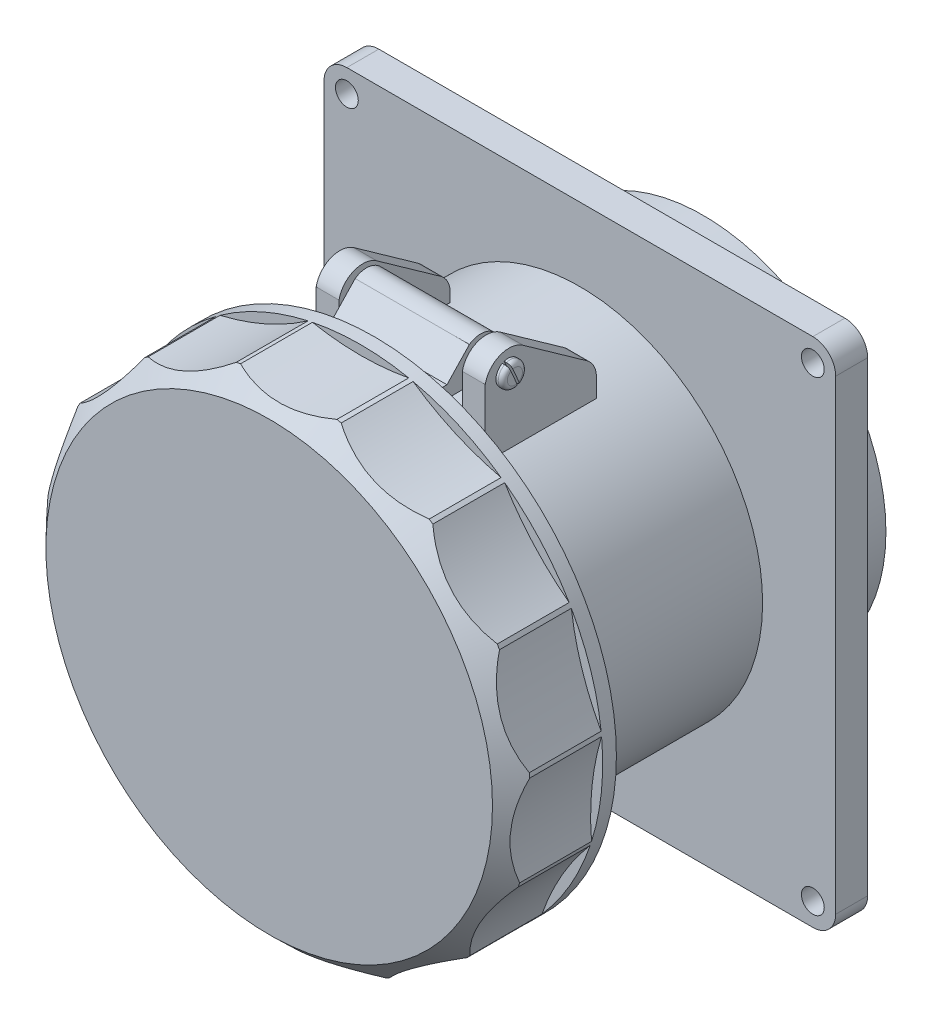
SolidWorks part; units mm, degrees
ref_plane "Plano frontal" through (0, 0, 0) normal (0, 0, 1) x (1, 0, 0)
ref_plane "Plano superior" through (0, 0, 0) normal (0, 1, 0) x (1, 0, 0)
ref_plane "Plano direito" through (0, 0, 0) normal (1, 0, 0) x (0, 0, -1)
sketch "Esboço1" plane through (0, 0, 0) normal (0, 0, 1) x (1, 0, 0)
  line L1 (-51, 56) -> (51, 56)
  line L2 (-56, 51) -> (-56, -51)
  line L3 (-51, -56) -> (51, -56)
  line L4 (56, 51) -> (56, -51)
  arc A0 (-51, 56) -> (-56, 51) centre (-51, 51) ccw
  arc A1 (51, 56) -> (56, 51) centre (51, 51) cw
  arc A2 (51, -56) -> (56, -51) centre (51, -51) ccw
  arc A3 (-56, -51) -> (-51, -56) centre (-51, -51) ccw
  circle A4 centre (-51, 51) radius 2.5
  circle A5 centre (51, 51) radius 2.5
  circle A6 centre (51, -51) radius 2.5
  circle A7 centre (-51, -51) radius 2.5
  point P9 (56, 56)
  point P12 (56, -56)
  point P15 (-56, -56)
  dimension "D5" = 5
  dimension "D6" = 5
  dimension "D1" = 112
  dimension "D2" = 56
  dimension "D3" = 112
  dimension "D4" = 56
  dimension "D7" = 5
  dimension "D8" = 5
extrude "Extrusão1" add sketch "Esboço1" along normal blind 7
sketch "Esboço2" plane through (0, 0, 7) normal (0, 0, 1) x (1, 0, 0)
  arc A0 (7.467, -39.2969) -> (-7.467, -39.2969) centre (0, 0) ccw
  arc A1 (-7.467, -39.2969) -> (7.467, -39.2969) centre (0, -40) ccw
  dimension "D1" = 80
extrude "Extrusão2" add sketch "Esboço2" along normal blind 45
sketch "Esboço3" plane through (0, 0, 52) normal (0, 0, 1) x (1, 0, 0)
  circle A0 centre (0, 0) radius 53
  dimension "D1" = 106
extrude "Extrusão3" add sketch "Esboço3" along normal blind 23
sketch "Esboço4" plane through (0, 0, 75) normal (0, 0, 1) x (1, 0, 0)
  line L0 (-10.5423, 51.9409) -> (-10.5423, 54.2056)
  line L1 (-10.5423, 54.2056) -> (10.5423, 54.2056)
  line L2 (10.5423, 54.2056) -> (10.5423, 51.9409)
  arc A0 (10.5423, 51.9409) -> (-10.5423, 51.9409) centre (0, 107.0856) cw
  circle A1 centre (0, 0) radius 53 construction
extrude "Corte-extrusão1" cut sketch "Esboço4" against normal blind 20
pattern_circular "CirPattern1" count 15 over 360 about axis through (0, 0, 0) along (0, 0, 1) of "Corte-extrusão1"
sketch "Esboço5" plane through (56, 0, 0) normal (1, 0, 0) x (0, 0, -1)
  line L0 (-52, 48.4252) -> (-48.5901, 48.4252)
  line L1 (-52, -53) -> (-52, 53) construction
  line L2 (-52, 45.7774) -> (-41.2084, 45.7774)
  line L3 (-43.6813, 53.6011) -> (-48.5901, 48.4252)
  line L4 (-52, 48.4252) -> (-53.584, 48.4252)
  line L5 (-53.584, 48.4252) -> (-53.584, 45.7774)
  line L6 (-53.584, 45.7774) -> (-52, 45.7774)
  arc A0 (-41.2084, 45.7774) -> (-43.6813, 53.6011) centre (-41.2084, 50.08) ccw
  circle A1 centre (-41.2084, 50.08) radius 2
  dimension "D1" = 4
extrude "Extrusão4" add sketch "Esboço5" against normal blind 25 from offset 43.5
sketch "Esboço6" plane through (12.5, 0, 0) normal (1, 0, 0) x (0, 0, -1)
  line L0 (-46.2097, 50.2765) -> (-46.2097, 26.1652)
  line L1 (-46.2097, 26.1652) -> (-21.8763, 26.1652)
  line L2 (-21.8763, 26.1652) -> (-21.8763, 39.5941)
  line L3 (-23.9812, 43.6707) -> (-37.9568, 53.5961)
  arc A0 (-37.9568, 53.5961) -> (-46.2097, 50.2765) centre (-41.0174, 49.2864) ccw
  arc A1 (-21.8763, 39.5941) -> (-23.9812, 43.6707) centre (-26.8763, 39.5941) ccw
  dimension "D1" = 5
extrude "Extrusão5" add sketch "Esboço6" along normal blind 5 from offset 1
mirror "Espelhar1" about plane through (0, 0, 0) normal (1, 0, 0) of "Extrusão5"
sketch "Esboço7" plane through (18.5, 0, 0) normal (1, 0, 0) x (0, 0, -1)
  line L0 (-42.4855, 52.4144) -> (-40.3907, 47.548)
  line L2 (-39.9621, 47.7291) -> (-42.0593, 52.6012)
  arc A0 (-42.4855, 52.4144) -> (-40.3907, 47.548) centre (-41.2084, 50.08) ccw
  arc A1 (-39.9621, 47.7291) -> (-42.0593, 52.6012) centre (-41.2084, 50.08) ccw
extrude "Extrusão6" add sketch "Esboço7" along normal blind 1.5
fillet "Filete1" radius 1 2 edges at (20, 51.1321, 38.7644) (20, 49.028, 43.6525)
mirror "Espelhar2" about plane through (0, 0, 0) normal (1, 0, 0) of "Extrusão6", "Filete1"
sketch "Esboço8" plane through (0, 0, 0) normal (0, 0, -1) x (-1, 0, 0)
  circle A0 centre (0, 0) radius 40
extrude "Extrusão7" add sketch "Esboço8" along normal blind 20
sketch "Esboço9" plane through (0, 0, 75) normal (0, 0, 1) x (1, 0, 0)
  circle A0 centre (0, 0) radius 48.8768
extrude "Corte-extrusão2" cut sketch "Esboço9" against normal blind 10 draft 44 flip side to cut
